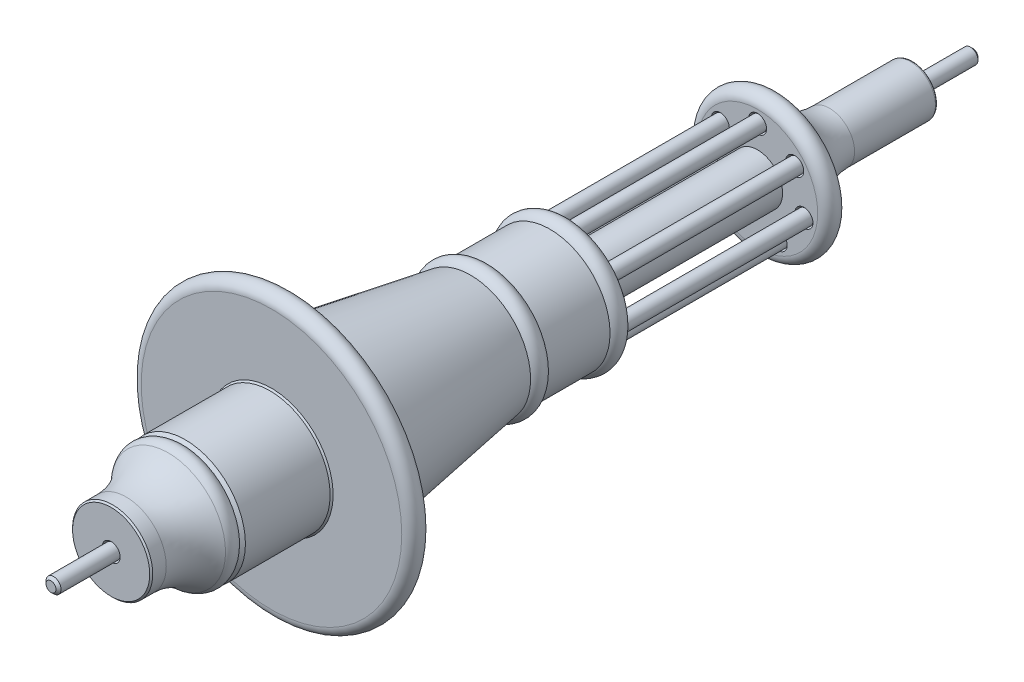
SolidWorks part; units mm, degrees
ref_plane "Спереди" through (0, 0, 0) normal (0, 0, 1) x (1, 0, 0)
ref_plane "Сверху" through (0, 0, 0) normal (0, 1, 0) x (1, 0, 0)
ref_plane "Справа" through (0, 0, 0) normal (1, 0, 0) x (0, 0, -1)
sketch "Эскиз1" plane through (0, 0, 0) normal (1, 0, 0) x (0, 0, -1)
  line L0 (0, 0) -> (66.65, 0) construction
  line L1 (0, 0.75) -> (66.65, 0.75)
  line L2 (0, 0.75) -> (0, 4)
  line L3 (0, 4) -> (1.5, 4)
  line L4 (16, 6) -> (16, 13)
  line L5 (18.2439, 8.3727) -> (17.9986, 13.0523)
  line L6 (7.1061, 5.7071) -> (7.399, 6)
  line L7 (7.399, 6) -> (16, 6)
  line L8 (36.7216, 6.5) -> (44.65, 6.5) construction
  line L9 (37.5876, 6) -> (43.784, 6)
  line L10 (19.2425, 8.425) -> (36.7216, 5.5) construction
  line L11 (35.8556, 6) -> (20.2241, 8.6158)
  line L12 (45.65, 5.5) -> (45.65, 3.5)
  line L13 (46.65, 2.5) -> (64.65, 2.5)
  line L14 (64.65, 2.5) -> (64.65, 2)
  line L15 (64.65, 2) -> (66.65, 2)
  line L16 (66.65, 2) -> (66.65, 0.75)
  arc A0 (1.5, 4) -> (5.6991, 5.7143) centre (1.5, 10) ccw
  arc A1 (7.1061, 5.7071) -> (5.6991, 5.7143) centre (6.399, 5) ccw
  arc A2 (17.9986, 13.0523) -> (16, 13) centre (17, 13) ccw
  arc A3 (20.2241, 8.6158) -> (18.2439, 8.3727) centre (19.2425, 8.425) ccw
  arc A4 (37.5876, 6) -> (35.8556, 6) centre (36.7216, 5.5) ccw
  arc A5 (45.65, 5.5) -> (43.784, 6) centre (44.65, 5.5) ccw
  arc A6 (45.65, 3.5) -> (46.65, 2.5) centre (46.65, 3.5) ccw
  dimension "D4" = 12
  dimension "D7" = 2
  dimension "D9" = 2
  dimension "D21" = 1
  dimension "D1" = 8
  dimension "D2" = 1.5
  dimension "D3" = 12
  dimension "D5" = 16
  dimension "D6" = 1.5
  dimension "D8" = 45
  dimension "D10" = 3
  dimension "D11" = 26
  dimension "D12" = 16.85
  dimension "D13" = 11
  dimension "D14" = 0.5
  dimension "D15" = 9.5
  dimension "D16" = 5
  dimension "D17" = 4
  dimension "D18" = 2
  dimension "D19" = 19
  dimension "D20" = 66.65
revolve "Повернуть1" add sketch "Эскиз1" angle 360 about L0
sketch "Эскиз2" plane through (0, 0, -45.65) normal (0, 0, -1) x (-1, 0, 0)
  line L0 (0, 4.75) -> (0, 0) construction
  line L1 (0, 0) -> (3.7137, 2.9616) construction
  circle A0 centre (0, 0) radius 4.75 construction
  circle A1 centre (0, 4.75) radius 0.75
  circle A2 centre (3.7137, 2.9616) radius 0.75
  circle A3 centre (4.6309, -1.057) radius 0.75
  circle A4 centre (2.0609, -4.2796) radius 0.75
  circle A5 centre (-2.0609, -4.2796) radius 0.75
  circle A6 centre (-4.6309, -1.057) radius 0.75
  circle A7 centre (-3.7137, 2.9616) radius 0.75
  dimension "D1" = 9.5
  dimension "D2" = 1.5
  dimension "D4" = 51.429
  dimension "D3" = 7
extrude "Вырез-Вытянуть1" cut sketch "Эскиз2" against normal blind 2
chamfer "Фаска1" distance 0.15 angle 45 21 edges at (-5.3809, -1.057, -45.65) (-5.3809, -1.057, -43.65) (-2.8109, -4.2796, -45.65) (-2.8109, -4.2796, -43.65) (-4.4637, 2.9616, -45.65) (-4.4637, 2.9616, -43.65) (-0.75, 4.75, -45.65) (-0.75, 4.75, -43.65) (2.9637, 2.9616, -45.65) (2.9637, 2.9616, -43.65) (1.3109, -4.2796, -45.65) (1.3109, -4.2796, -43.65) (3.8809, -1.057, -45.65) (3.8809, -1.057, -43.65) (0.75, 0, 0) (0.75, 0, -66.65) (6, 0, -16) (4, 0, 0) (2, 0, -64.65) (2.5, 0, -64.65) (2, 0, -66.65)
sketch "Эскиз3" plane through (0, 0, 0) normal (1, 0, 0) x (0, 0, -1)
  line L0 (64.5, 0) -> (80, 0) construction
  line L1 (64.5, 2.5) -> (64.5, -2.5) construction
  line L2 (64.5, 2.5) -> (64.65, 2.35)
  line L3 (64.65, 2.35) -> (64.65, 2.15)
  line L4 (64.65, 2.15) -> (64.8, 2)
  line L5 (66.5, 2) -> (64.8, 2) construction
  line L6 (64.8, 2) -> (66.5, 2)
  line L7 (66.5, 2) -> (66.65, 1.85)
  line L8 (66.65, 1.85) -> (66.65, 0.9)
  line L9 (66.65, -1.85) -> (66.65, 1.85) construction
  line L10 (66.65, 0.9) -> (66.8, 0.75)
  line L11 (66.8, 0.75) -> (79.85, 0.75)
  line L12 (79.85, 0.75) -> (80, 0.9)
  line L13 (64.5, 2.5) -> (64.5, 6)
  line L14 (80, 0.9) -> (80, 2.25)
  line L15 (71.6847, 2.5) -> (79.75, 2.5)
  arc A0 (66.4515, 6.3077) -> (64.5, 6) centre (65.5, 6) ccw
  arc A1 (66.4515, 6.3077) -> (71.6847, 2.5) centre (71.6847, 8) ccw
  arc A2 (80, 2.25) -> (79.75, 2.5) centre (79.75, 2.25) ccw
  dimension "D2" = 2
  dimension "D5" = 11
  dimension "D7" = 0.25
  dimension "D1" = 1.5
  dimension "D3" = 15.5
  dimension "D4" = 12
  dimension "D6" = 5
revolve "Повернуть2" add sketch "Эскиз3" angle 360 about L0
sketch "Эскиз4" plane through (0, 0, -64.5) normal (0, 0, 1) x (1, 0, 0)
  circle A1 centre (2.0609, -4.2796) radius 0.75
  circle A2 centre (2.0609, -4.2796) radius 0.75
  circle A3 centre (-2.0609, -4.2796) radius 0.75
  circle A4 centre (-2.0609, -4.2796) radius 0.75
  circle A5 centre (-4.6309, -1.057) radius 0.75
  circle A6 centre (-4.6309, -1.057) radius 0.75
  circle A7 centre (-3.7137, 2.9616) radius 0.75
  circle A8 centre (-3.7137, 2.9616) radius 0.75
  circle A9 centre (0, 4.75) radius 0.75
  circle A10 centre (0, 4.75) radius 0.75
  circle A11 centre (3.7137, 2.9616) radius 0.75
  circle A12 centre (3.7137, 2.9616) radius 0.75
  circle A13 centre (4.6309, -1.057) radius 0.75
  circle A14 centre (4.6309, -1.057) radius 0.75
  dimension "D1" = 0
  dimension "D2" = 0
  dimension "D3" = 0
  dimension "D4" = 0
  dimension "D5" = 0
  dimension "D6" = 0
  dimension "D7" = 0
extrude "Вырез-Вытянуть2" cut sketch "Эскиз4" against normal blind 2
chamfer "Фаска2" distance 0.15 angle 45 14 edges at (-1.3109, -4.2796, -64.5) (-1.3109, -4.2796, -66.5) (-3.8809, -1.057, -64.5) (-3.8809, -1.057, -66.5) (2.8109, -4.2796, -64.5) (2.8109, -4.2796, -66.5) (5.3809, -1.057, -64.5) (5.3809, -1.057, -66.5) (4.4637, 2.9616, -64.5) (4.4637, 2.9616, -66.5) (0.75, 4.75, -64.5) (0.75, 4.75, -66.5) (-2.9637, 2.9616, -64.5) (-2.9637, 2.9616, -66.5)
sketch "Эскиз5" plane through (0, 0, -43.65) normal (0, 0, -1) x (-1, 0, 0)
  circle A1 centre (-2.0609, -4.2796) radius 0.75
  circle A2 centre (-2.0609, -4.2796) radius 0.75
  circle A3 centre (2.0609, -4.2796) radius 0.75
  circle A4 centre (2.0609, -4.2796) radius 0.75
  circle A5 centre (4.6309, -1.057) radius 0.75
  circle A6 centre (4.6309, -1.057) radius 0.75
  circle A7 centre (3.7137, 2.9616) radius 0.75
  circle A8 centre (3.7137, 2.9616) radius 0.75
  circle A9 centre (0, 4.75) radius 0.75
  circle A10 centre (0, 4.75) radius 0.75
  circle A11 centre (-3.7137, 2.9616) radius 0.75
  circle A12 centre (-3.7137, 2.9616) radius 0.75
  circle A13 centre (-4.6309, -1.057) radius 0.75
  circle A14 centre (-4.6309, -1.057) radius 0.75
  dimension "D1" = 0
  dimension "D2" = 0
  dimension "D3" = 0
  dimension "D4" = 0
  dimension "D5" = 0
  dimension "D6" = 0
  dimension "D7" = 0
extrude "Бобышка-Вытянуть1" add sketch "Эскиз5" along normal up to surface (22.85 mm away) separate body
chamfer "Фаска3" distance 0.15 angle 45 2 edges at (-0.75, 4.75, -43.65) (0.75, 4.75, -66.5)
chamfer "Фаска4" distance 0.15 angle 45 2 edges at (-4.4637, 2.9616, -43.65) (-2.9637, 2.9616, -66.5)
chamfer "Фаска5" distance 0.15 angle 45 2 edges at (-5.3809, -1.057, -43.65) (-3.8809, -1.057, -66.5)
chamfer "Фаска6" distance 0.15 angle 45 2 edges at (2.9637, 2.9616, -43.65) (4.4637, 2.9616, -66.5)
chamfer "Фаска7" distance 0.15 angle 45 2 edges at (3.8809, -1.057, -43.65) (5.3809, -1.057, -66.5)
chamfer "Фаска8" distance 0.15 angle 45 2 edges at (1.3109, -4.2796, -43.65) (2.8109, -4.2796, -66.5)
chamfer "Фаска9" distance 0.15 angle 45 2 edges at (-2.8109, -4.2796, -43.65) (-1.3109, -4.2796, -66.5)
sketch "Эскиз6" plane through (0, 0, 0) normal (1, 0, 0) x (0, 0, -1)
  line L0 (-6, 0) -> (86, 0) construction
  line L1 (-6, 0) -> (-6, 0.5)
  line L2 (-5.75, 0.75) -> (85.75, 0.75)
  line L3 (86, 0.5) -> (86, 0)
  line L4 (80, -2.25) -> (80, 2.25) construction
  line L5 (0, 3.85) -> (0, -3.85) construction
  line L6 (-6, 0.5) -> (-5.75, 0.75)
  line L7 (85.75, 0.75) -> (86, 0.5)
  line L8 (-6, 0) -> (86, 0)
  point P4 (-6, 0.75)
  point P5 (86, 0.75)
  dimension "D1" = 1.5
  dimension "D2" = 6
  dimension "D3" = 6
  dimension "D6" = 0.25
  dimension "D7" = 0.25
revolve "Повернуть3" add sketch "Эскиз6" angle 360 about L0
